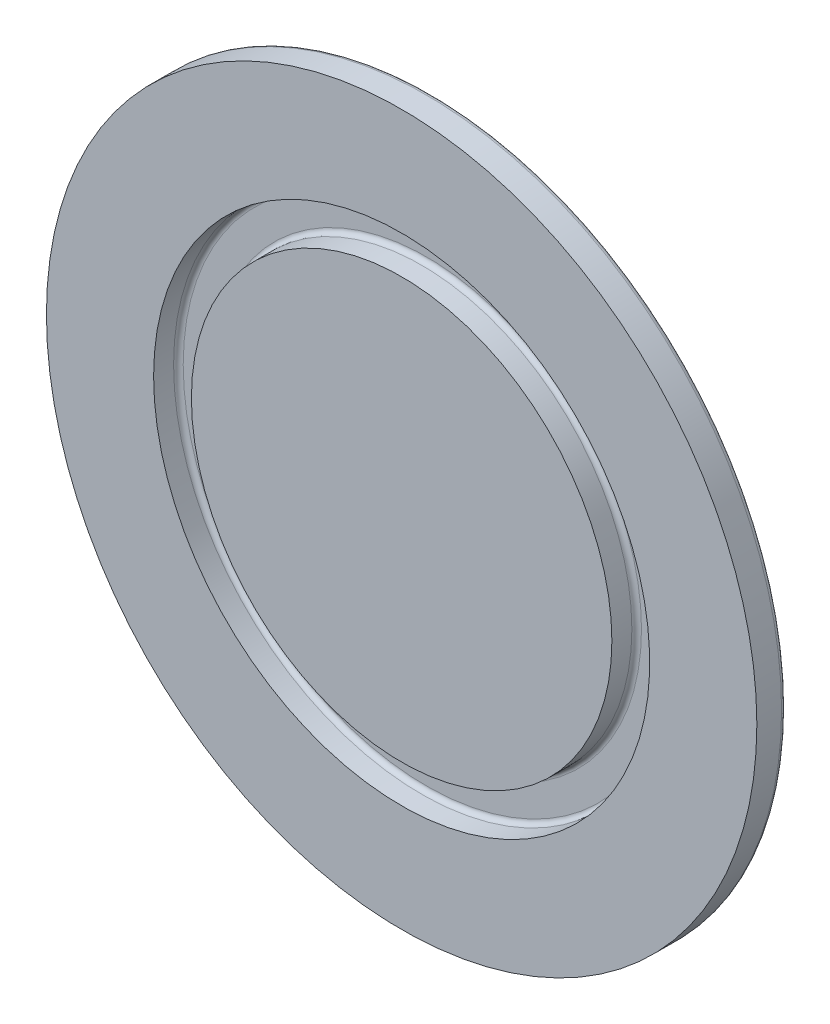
SolidWorks part; units mm, degrees
ref_plane "Front Plane" through (0, 0, 0) normal (0, 0, 1) x (1, 0, 0)
ref_plane "Top Plane" through (0, 0, 0) normal (0, 1, 0) x (1, 0, 0)
ref_plane "Right Plane" through (0, 0, 0) normal (1, 0, 0) x (0, 0, -1)
sketch "Sketch1" plane through (0, 0, 0) normal (1, 0, 0) x (0, 0, -1)
  line L0 (-2.54, 0) -> (2.54, 0) construction
  line L1 (2.54, -37.465) -> (2.54, 37.465) construction
  line L2 (-2.54, -25.4) -> (-2.54, 25.4) construction
  line L3 (-2.54, 22.1742) -> (0.0762, 22.1742)
  line L4 (0.0762, 22.1742) -> (0.0762, 26.162)
  line L5 (0.0762, 26.162) -> (-2.54, 26.162)
  line L6 (-2.54, 26.162) -> (-2.54, 37.465)
  line L10 (-2.54, 0) -> (-2.54, 22.1742)
  line L11 (0.4572, 37.465) -> (2.54, 29.6919)
  line L12 (-2.54, 37.465) -> (0.4572, 37.465)
  line L13 (2.54, 29.6919) -> (2.54, 0)
  line L14 (2.54, 0) -> (-2.54, 0)
  point P7 (-2.54, 22.1742)
  point P8 (-2.54, -22.1742)
  dimension "D1" = 105
  dimension "Flange OD" = 74.93
  dimension "For Tube OD" = 50.8
  dimension "Length" = 5.08
  dimension "Inner Connection Diameter" = 44.3484
  dimension "Connection Depth" = 2.6162
  dimension "Outer Connection Diameter" = 52.324
  dimension "Flange Flat" = 2.9972
sketch "Sketch2" plane through (0, 0, 0) normal (1, 0, 0) x (0, 0, -1)
  line L0 (2.54, 29.6919) -> (2.54, 0) construction
  line L1 (2.54, 0) -> (-2.54, 0) construction
  line L2 (-2.54, 0) -> (-2.54, 22.1742) construction
  line L3 (-2.54, 22.1742) -> (0.0762, 22.1742) construction
  line L4 (0.0762, 22.1742) -> (0.0762, 26.162) construction
  line L5 (0.0762, 26.162) -> (-2.54, 26.162) construction
  line L6 (-2.54, 26.162) -> (-2.54, 37.465) construction
  line L7 (0.4572, 37.465) -> (2.54, 29.6919) construction
  line L8 (-2.54, 37.465) -> (0.4572, 37.465) construction
  line L9 (2.54, 29.6919) -> (2.54, 0)
  line L10 (2.54, 0) -> (-2.54, 0)
  line L11 (-2.54, 0) -> (-2.54, 22.1742)
  line L12 (-2.54, 22.1742) -> (-0.4318, 22.1742)
  line L13 (0.0762, 22.6822) -> (0.0762, 25.654)
  line L14 (-0.4318, 26.162) -> (-2.54, 26.162)
  line L15 (-2.54, 26.162) -> (-2.54, 37.465)
  line L16 (0.5581, 37.0885) -> (2.54, 29.6919)
  line L17 (-2.54, 37.465) -> (0.0674, 37.465)
  arc A0 (0.5581, 37.0885) -> (0.0674, 37.465) centre (0.0674, 36.957) ccw
  arc A1 (0.0762, 22.6822) -> (-0.4318, 22.1742) centre (-0.4318, 22.6822) cw
  arc A2 (0.0762, 25.654) -> (-0.4318, 26.162) centre (-0.4318, 25.654) ccw
  dimension "D1" = 0.508
revolve "Revolve1" add sketch "Sketch2" angle 360 about L10
sketch "Sketch3" plane through (0, 0, 0) normal (0, 0, 1) x (1, 0, 0)
  circle A0 centre (0, 0) radius 25.4
